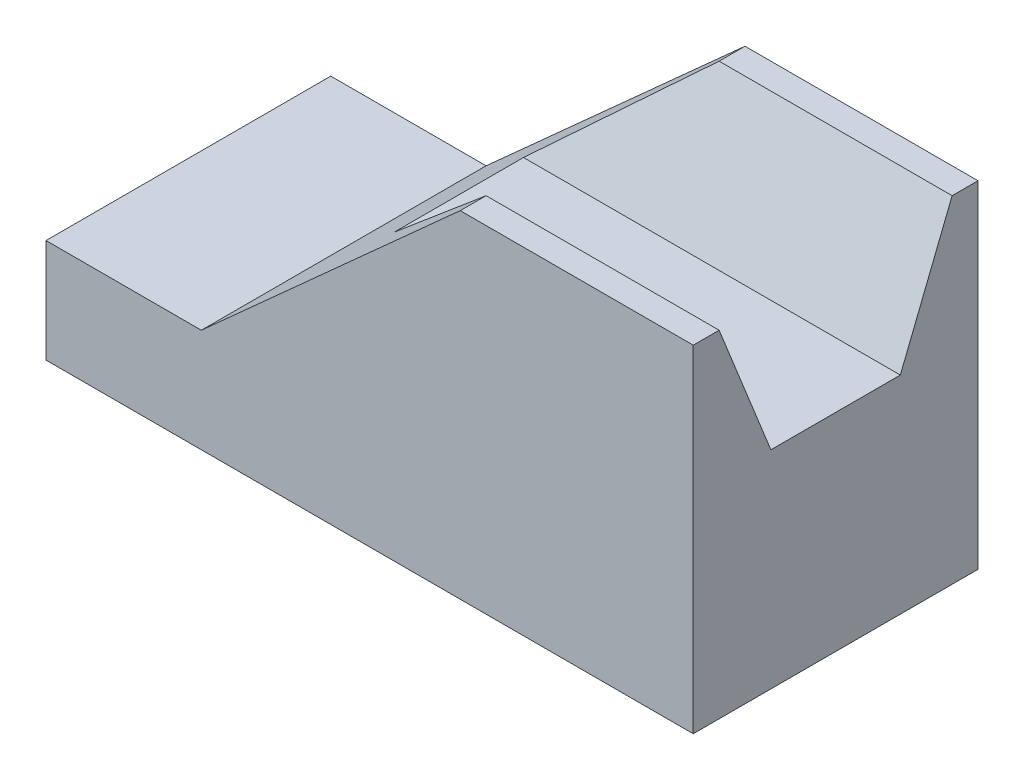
SolidWorks part; units mm, degrees
ref_plane "前视基准面" through (0, 0, 0) normal (0, 0, 1) x (1, 0, 0)
ref_plane "上视基准面" through (0, 0, 0) normal (0, 1, 0) x (1, 0, 0)
ref_plane "右视基准面" through (0, 0, 0) normal (1, 0, 0) x (0, 0, -1)
sketch "草图1" plane through (0, 0, 0) normal (0, 0, 1) x (1, 0, 0)
  line L0 (0, 0) -> (50, 0)
  line L1 (50, 0) -> (50, 26)
  line L2 (50, 26) -> (32, 26)
  line L3 (32, 26) -> (12, 8)
  line L4 (12, 8) -> (0, 8)
  line L5 (0, 8) -> (0, 0)
  dimension "D1" = 50
  dimension "D2" = 26
  dimension "D3" = 18
  dimension "D4" = 8
  dimension "D5" = 12
extrude "拉伸1" add sketch "草图1" along normal mid plane 22
sketch "草图2" plane through (50, 0, 0) normal (1, 0, 0) x (0, 0, -1)
  line L0 (0, 0) -> (0, 28.8459) construction
  line L1 (9, 26) -> (5, 16)
  line L2 (-11, 26) -> (11, 26) construction
  line L3 (5, 16) -> (-5, 16)
  line L4 (9, 26) -> (-9, 26)
  line L5 (-9, 26) -> (-5, 16)
  point P10 (0, 26)
  point P11 (0, 16)
  dimension "D1" = 10
  dimension "D2" = 5
extrude "切除-拉伸1" cut sketch "草图2" against normal through all
